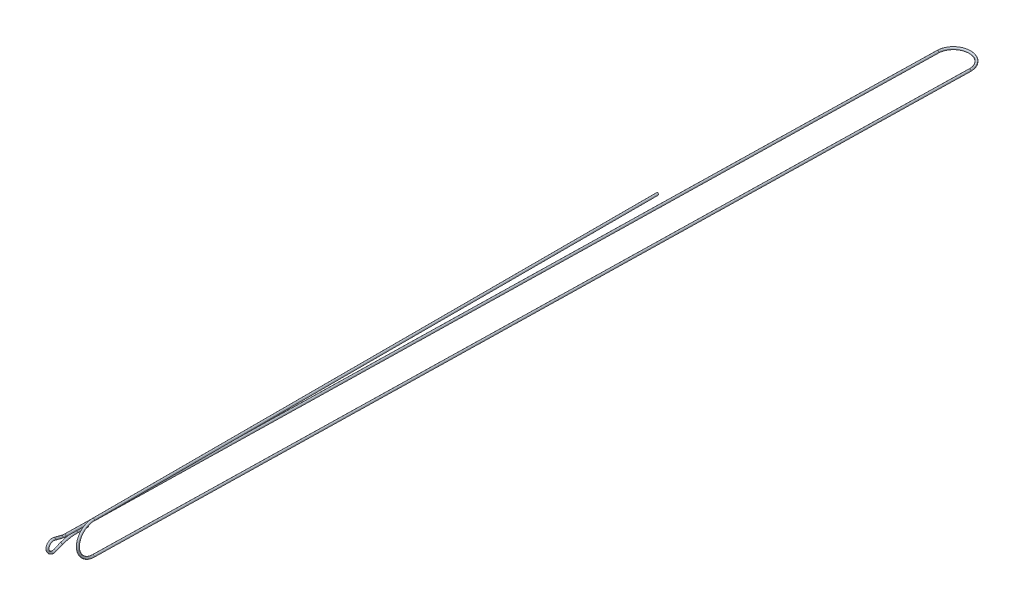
SolidWorks part; units mm, degrees
ref_plane "Plan de face" through (0, 0, 0) normal (0, 0, 1) x (1, 0, 0)
ref_plane "Plan de dessus" through (0, 0, 0) normal (0, 1, 0) x (1, 0, 0)
ref_plane "Plan de droite" through (0, 0, 0) normal (1, 0, 0) x (0, 0, -1)
imported_body "Importée3"
sketch "Esquisse1" plane through (0, 0, 0) normal (0, 0, -1) x (-1, 0, 0)
  circle A0 centre (0, 29) radius 2
extrude "Boss.-Extru.1" add sketch "Esquisse1" along normal blind 1040
sketch "Esquisse2" plane through (0, 0, 0) normal (1, 0, 0) x (0, 0, -1)
  circle A0 centre (0, 0) radius 27
  circle A1 centre (-16.0572, -34.4309) radius 8
sketch "Esquisse3" plane through (0, 0, 0) normal (0, 1, 0) x (1, 0, 0)
  circle A0 centre (-29.5, 1616.0097) radius 27.5
